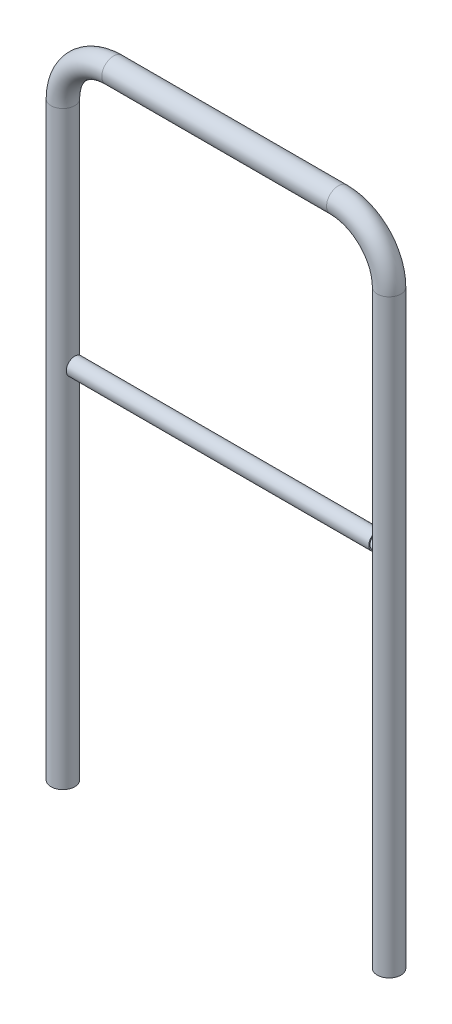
SolidWorks part; units mm, degrees
ref_plane "Ebene vorne" through (0, 0, 0) normal (0, 0, 1) x (1, 0, 0)
ref_plane "Ebene oben" through (0, 0, 0) normal (0, 1, 0) x (1, 0, 0)
ref_plane "Ebene rechts" through (0, 0, 0) normal (1, 0, 0) x (0, 0, -1)
sketch "Skizze1" plane through (0, 0, 0) normal (0, 0, 1) x (1, 0, 0)
  line L0 (-579, 0) -> (-579, 1047)
  line L1 (-489, 1137) -> (-90, 1137)
  line L2 (0, 1047) -> (0, 0)
  line L3 (-579, 647) -> (0, 647)
  arc A0 (-90, 1137) -> (0, 1047) centre (-90, 1047) cw
  arc A1 (-579, 1047) -> (-489, 1137) centre (-489, 1047) cw
  point P10 (0, 1137)
  point P13 (-579, 1137)
  dimension "D4" = 90
  dimension "D1" = 1137
  dimension "D2" = 579
  dimension "D3" = 490
other "Strukturbauteil1"
ref_plane "Ebene1" through (-579, 0, 0) normal (0, 1, 0) x (-1, 0, 0)
sketch "Skizze18" plane through (-579, 0, 0) normal (0, 1, 0) x (-1, 0, 0)
  circle A0 centre (0, 0) radius 21
  circle A1 centre (0, 0) radius 18.5
  point P4 (0, 0)
  dimension "D1" = 42
  dimension "D2" = 2.5
other "Strukturbauteil2"
ref_plane "Ebene2" through (-579, 647, 0) normal (1, 0, 0) x (0, 0, -1)
sketch "Skizze12" plane through (-579, 647, 0) normal (1, 0, 0) x (0, 0, -1)
  line L0 (-15, 0) -> (15, 0) construction
  line L1 (0, 15) -> (0, -15) construction
  circle A0 centre (0, 0) radius 15
  circle A1 centre (0, 0) radius 13
  point P9 (0, 0)
  dimension "D2" = 30
  dimension "D1" = 2
sketch "Skizze13" plane through (0, 0, 0) normal (0, 0, 1) x (1, 0, 0)
  line L0 (-558, 1158) -> (-558, 0)
  line L1 (-600, 0) -> (-558, 0) construction
  line L2 (-558, 0) -> (-558, 1047) construction
  line L3 (-90, 1158) -> (-489, 1158) construction
extrude "Schnitt-Linear austragen1" cut sketch "Skizze13" against normal through all and the other way through all flip side to cut
sketch "Skizze14" plane through (0, 0, 0) normal (0, 0, 1) x (1, 0, 0)
  line L0 (-21, 1158) -> (-21, 0)
  line L1 (-90, 1158) -> (-489, 1158) construction
  line L2 (-21, 1047) -> (-21, 0) construction
extrude "Schnitt-Linear austragen2" cut sketch "Skizze14" against normal through all and the other way through all
ref_plane "Ebene3" through (0, 60, 0) normal (0, 1, 0) x (-1, 0, 0)
sketch "Skizze19" plane through (0, 60, 0) normal (0, 1, 0) x (-1, 0, 0)
  line L1 (584, -21) -> (-5, -21)
  line L2 (584, -21) -> (584, -24)
  line L3 (584, -24) -> (-5, -24)
  line L4 (-5, -21) -> (-5, -24)
  circle A0 centre (579, 0) radius 21 construction
  circle A1 centre (0, 0) radius 21 construction
  dimension "D2" = 5
  dimension "D3" = 5
  dimension "D1" = 3
extrude "Linear austragen1" [suppressed] add sketch "Skizze19" along normal blind 120 separate body
